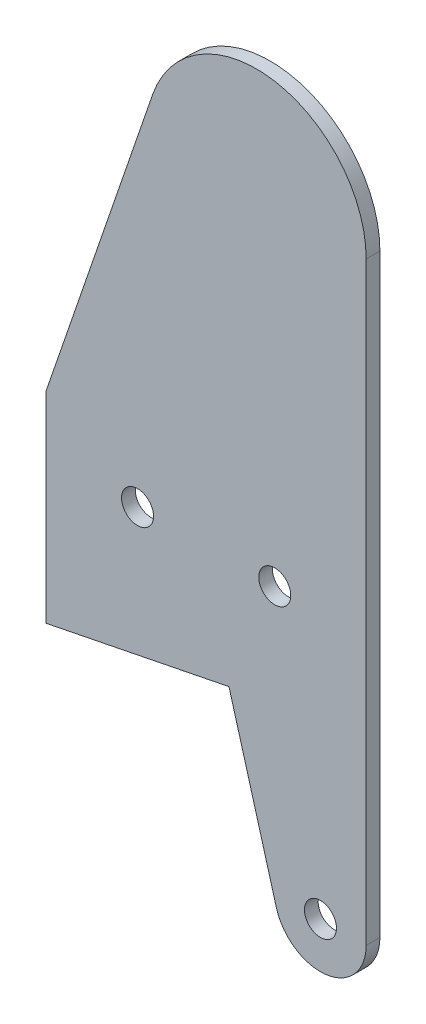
SolidWorks part; units mm, degrees
ref_plane "Front Plane" through (0, 0, 0) normal (0, 0, 1) x (1, 0, 0)
ref_plane "Top Plane" through (0, 0, 0) normal (0, 1, 0) x (1, 0, 0)
ref_plane "Right Plane" through (0, 0, 0) normal (1, 0, 0) x (0, 0, -1)
sketch "Sketch1" plane through (0, 0, 0) normal (0, 0, 1) x (1, 0, 0)
  line L0 (5, 0) -> (5, 65)
  line L1 (-30, 13) -> (-10, 17)
  line L2 (-10, 17) -> (-4.8116, -1.3597)
  line L3 (-30, 13) -> (-30, 35)
  line L4 (-30, 35) -> (-18.3484, 68.9005)
  arc A0 (-4.8116, -1.3597) -> (5, 0) centre (0, 0) ccw
  circle A1 centre (0, 0) radius 1.75
  arc A2 (5, 65) -> (-18.3484, 68.9005) centre (-7, 65) ccw
  circle A3 centre (-5, 29) radius 1.75
  circle A4 centre (-20, 29) radius 1.75
  dimension "D1" = 17
  dimension "D10" = 12
  dimension "D11" = 5
  dimension "D2" = 15
  dimension "D3" = 16
  dimension "D4" = 22
  dimension "D5" = 12
  dimension "D6" = 36
  dimension "D7" = 10
  dimension "D8" = 15
  dimension "D9" = 10
extrude "Extrude1" add sketch "Sketch1" along normal blind 1.5
